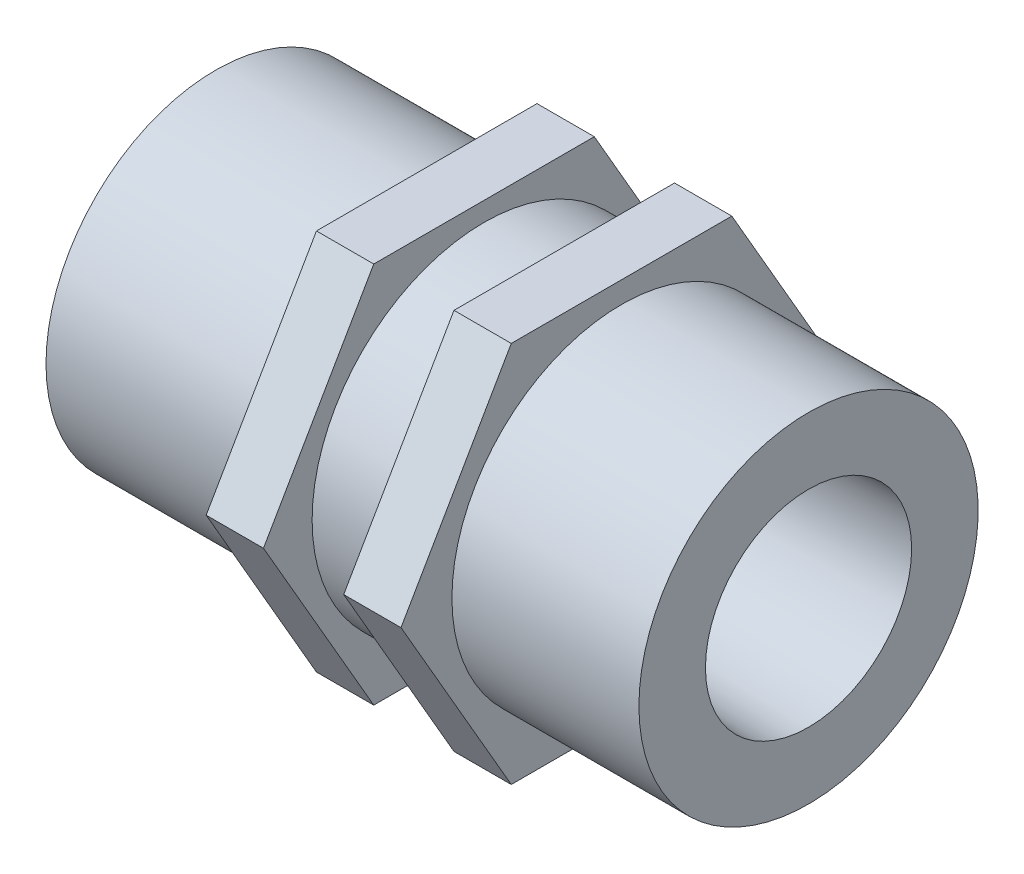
SolidWorks part; units mm, degrees
ref_plane "Front Plane" through (0, 0, 0) normal (0, 0, 1) x (1, 0, 0)
ref_plane "Top Plane" through (0, 0, 0) normal (0, 1, 0) x (1, 0, 0)
ref_plane "Right Plane" through (0, 0, 0) normal (1, 0, 0) x (0, 0, -1)
imported_body "Imported3"
sketch "Sketch1" plane through (37.846, 0, 0) normal (1, 0, 0) x (0, 0, -1)
  circle A0 centre (0, 0) radius 7.112
extrude "Boss-Extrude1" add sketch "Sketch1" along normal blind 3.048
sketch "Sketch2" plane through (3.048, 0, 0) normal (-1, 0, 0) x (0, 0, 1)
  circle A0 centre (0, 0) radius 7.112
extrude "Boss-Extrude2" add sketch "Sketch2" along normal blind 3.048
sketch "Sketch7" plane through (0, 0, 0) normal (0, 0, 1) x (1, 0, 0)
  line L0 (0, 0) -> (43.8207, 0) construction
  line L1 (17.78, 3.175) -> (17.78, -3.175) construction
  line L2 (17.78, 0) -> (23.114, 0)
  line L3 (17.78, 0) -> (17.78, 11.43)
  line L4 (17.78, 11.43) -> (23.114, 11.43)
  line L5 (23.114, 0) -> (23.114, 11.43)
  line L6 (23.114, -3.175) -> (23.114, 3.175) construction
  dimension "D1" = 11.43
revolve "Revolve1" add sketch "Sketch7" angle 360 about L0
sketch "Sketch8" plane through (17.78, 0, 0) normal (-1, 0, 0) x (0, 0, 1)
  line L1 (7.3323, 12.7) -> (-7.3323, 12.7)
  line L2 (-7.3323, 12.7) -> (-14.6647, 0)
  line L3 (-14.6647, 0) -> (-7.3323, -12.7)
  line L4 (-7.3323, -12.7) -> (7.3323, -12.7)
  line L5 (7.3323, -12.7) -> (14.6647, 0)
  line L6 (14.6647, 0) -> (7.3323, 12.7)
  circle A0 centre (0, 0) radius 12.7 construction
  dimension "D1" = 25.4
extrude "Boss-Extrude5" add sketch "Sketch8" along normal blind 3.81
ref_plane "Plane3" through (20.447, 0, 0) normal (1, 0, 0) x (0, 0, -1)
mirror "Mirror1" about plane through (20.447, 0, 0) normal (1, 0, 0) of "Boss-Extrude5"
sketch "Sketch14" plane through (0, 0, 0) normal (0, 0, 1) x (1, 0, 0)
  line L0 (13.97, 0) -> (13.97, 12.7) construction
  line L1 (13.97, 11.3072) -> (-1.6385, 11.3072)
  line L2 (13.97, 11.3072) -> (13.97, -10.6496)
  line L3 (13.97, -10.6496) -> (-1.6385, -10.6496)
  line L4 (-1.6385, 11.3072) -> (-1.6385, -10.6496)
  line L5 (26.924, 0) -> (26.924, 12.7) construction
  line L6 (26.924, 11.3072) -> (41.8177, 11.3072)
  line L7 (26.924, 11.3072) -> (26.924, -11.0499)
  line L8 (26.924, -11.0499) -> (41.8177, -11.0499)
  line L9 (41.8177, 11.3072) -> (41.8177, -11.0499)
extrude "Cut-Extrude1" cut sketch "Sketch14" against normal mid plane 25.4
sketch "Sketch10" plane through (0, 0, 0) normal (0, 0, 1) x (1, 0, 0)
  line L0 (13.97, 0) -> (13.97, 12.7) construction
  line L1 (13.97, 11.2786) -> (-0.066, 11.2786)
  line L2 (13.97, 11.2786) -> (13.97, 0)
  line L3 (-0.066, 0) -> (13.97, 0)
  line L4 (-0.066, 11.2786) -> (-0.066, 0)
  line L5 (0, 0) -> (44.0477, 0) construction
  line L6 (26.924, 11.2786) -> (39.3573, 11.2786)
  line L9 (26.924, 0) -> (26.924, 12.7) construction
  line L11 (39.3573, 11.2786) -> (39.3573, 0)
  line L12 (39.3573, 0) -> (26.924, 0)
  line L13 (26.924, 0) -> (26.924, 11.2786)
revolve "Revolve4" add sketch "Sketch10" angle 360 about L5
hole_wizard "1/4 NPT Tapped Hole1" positions "Sketch16" profile "Sketch15" size "1/4" standard "ANSI Inch"
sketch "Sketch16" plane through (-0.066, 0, 0) normal (-1, 0, 0) x (0, 0, 1)
  point P0 (0, 0)
sketch "Sketch15" plane through (-0.066, 0, 0) normal (0, 1, 0) x (0, 0, 1)
  line L0 (0, 0) -> (0, 20.3603)
  line L1 (5.5626, 17.018) -> (0, 20.3603)
  line L2 (-5.5626, 17.018) -> (0, 20.3603) construction
  line L3 (5.5626, 17.018) -> (5.5626, 9.906)
  line L4 (5.5626, 9.906) -> (6.558, 9.906)
  line L5 (6.558, 9.906) -> (6.8546, 0)
  line L6 (-6.558, 9.906) -> (-6.8546, 0) construction
  line L7 (6.8546, 0) -> (0, 0)
  line L8 (0, -6.35) -> (0, 107.95) construction
  line L11 (-5.5626, 9.906) -> (-6.558, 9.906) construction
  dimension "Tap Drill Dia." = 11.1252
  dimension "Tap Drill Depth" = 17.018
  dimension "Thread Dia." = 13.7092
  dimension "Thread Angle" = 3.43
  dimension "Thread Depth" = 9.906
  dimension "Drill Angle" = 118
hole_wizard "1/4 NPT Tapped Hole2" positions "Sketch18" profile "Sketch17" size "1/4" standard "ANSI Inch"
sketch "Sketch18" plane through (39.3573, 0, 0) normal (1, 0, 0) x (0, 0, -1)
  point P0 (0, 0)
sketch "Sketch17" plane through (39.3573, 0, 0) normal (0, 1, 0) x (0, 0, -1)
  line L0 (0, 0) -> (0, 20.3603)
  line L1 (5.5626, 17.018) -> (0, 20.3603)
  line L2 (-5.5626, 17.018) -> (0, 20.3603) construction
  line L3 (5.5626, 17.018) -> (5.5626, 9.906)
  line L4 (5.5626, 9.906) -> (6.558, 9.906)
  line L5 (6.558, 9.906) -> (6.8546, 0)
  line L6 (-6.558, 9.906) -> (-6.8546, 0) construction
  line L7 (6.8546, 0) -> (0, 0)
  line L8 (0, -6.35) -> (0, 107.95) construction
  line L11 (-5.5626, 9.906) -> (-6.558, 9.906) construction
  dimension "Tap Drill Dia." = 11.1252
  dimension "Tap Drill Depth" = 17.018
  dimension "Thread Dia." = 13.7092
  dimension "Thread Angle" = 3.43
  dimension "Thread Depth" = 9.906
  dimension "Drill Angle" = 118
